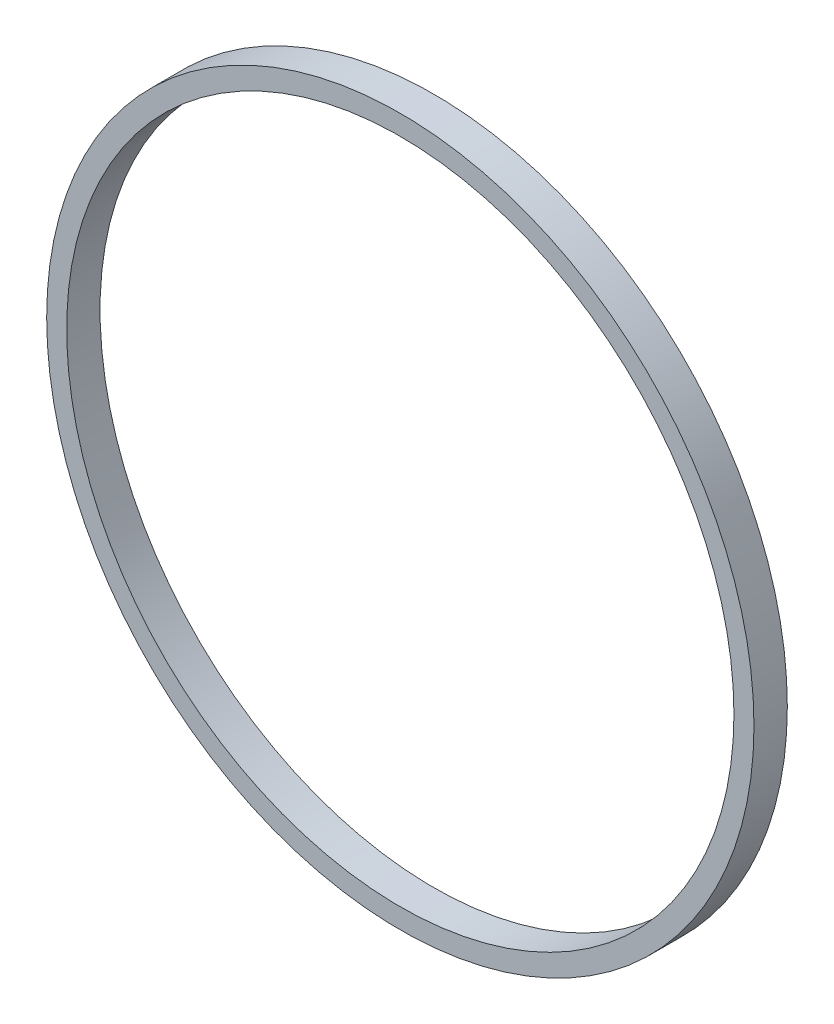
SolidWorks part; units mm, degrees
ref_plane "Plan de face" through (0, 0, 0) normal (0, 0, 1) x (1, 0, 0)
ref_plane "Plan de dessus" through (0, 0, 0) normal (0, 1, 0) x (1, 0, 0)
ref_plane "Plan de droite" through (0, 0, 0) normal (1, 0, 0) x (0, 0, -1)
sketch "Esquisse1" plane through (0, 0, 0) normal (0, 0, 1) x (1, 0, 0)
  circle A0 centre (0, 0) radius 25
  circle A1 centre (0, 0) radius 26.5
  dimension "D1" = 50
  dimension "D2" = 53
extrude "Extrusion1" add sketch "Esquisse1" along normal blind 2.5
